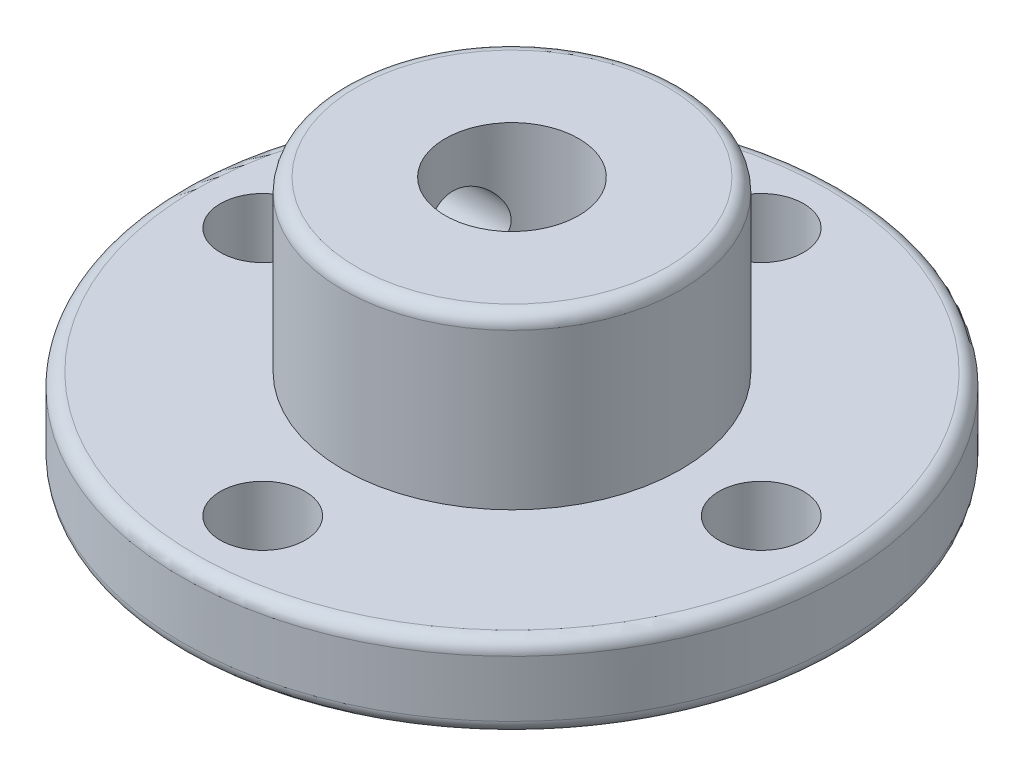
SolidWorks part; units mm, degrees
other "<Part.mount>-<Imported1>"
ref_plane "Front Plane" through (0, 0, 0) normal (0, 0, 1) x (1, 0, 0)
ref_plane "Top Plane" through (0, 0, 0) normal (0, 1, 0) x (1, 0, 0)
ref_plane "Right Plane" through (0, 0, 0) normal (1, 0, 0) x (0, 0, -1)
mirrored part "Part.mount_Mirrored"
